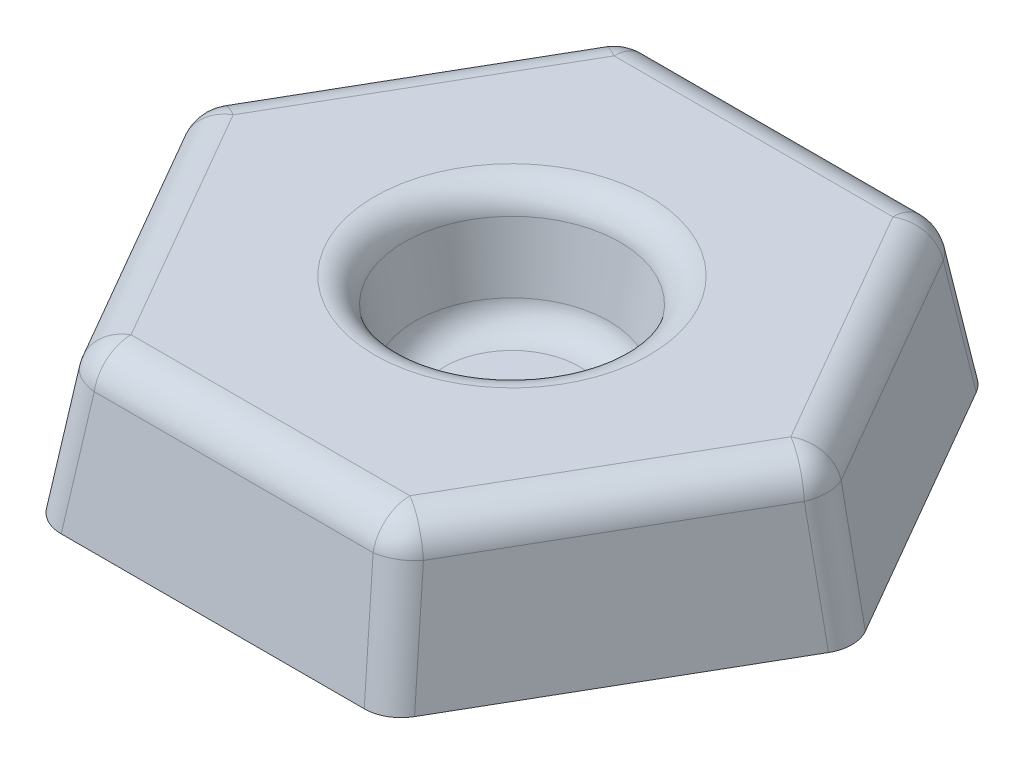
SolidWorks part; units mm, degrees
ref_plane "Front" through (0, 0, 0) normal (0, 0, 1) x (1, 0, 0)
ref_plane "Top" through (0, 0, 0) normal (0, 1, 0) x (1, 0, 0)
ref_plane "Right" through (0, 0, 0) normal (1, 0, 0) x (0, 0, -1)
sketch "Sketch1" plane through (0, 0, 0) normal (0, 1, 0) x (1, 0, 0)
  line L1 (-46.188, 0) -> (-23.094, -40)
  line L2 (-23.094, -40) -> (23.094, -40)
  line L3 (23.094, -40) -> (46.188, 0)
  line L4 (46.188, 0) -> (23.094, 40)
  line L5 (23.094, 40) -> (-23.094, 40)
  line L6 (-23.094, 40) -> (-46.188, 0)
  circle A0 centre (0, 0) radius 40 construction
  dimension "D1" = 80
extrude "Boss-Extrude1" add sketch "Sketch1" along normal blind 20 draft 10
sketch "Sketch2" plane through (0, 20, 0) normal (0, 1, 0) x (1, 0, 0)
  circle A0 centre (0, 0) radius 15
  dimension "D1" = 30
extrude "Cut-Extrude1" cut sketch "Sketch2" against normal blind 15 draft 10
fillet "Fillet1" radius 5 6 edges at (22.076, 10, -38.2367) (44.152, 10, 0) (22.076, 10, 38.2367) (-22.076, 10, 38.2367) (-44.152, 10, 0) (-22.076, 10, -38.2367)
fillet "Fillet2" radius 5 12 edges at (-41.3559, 20, 0) (-31.5869, 20, -18.2367) (-20.678, 20, -35.8153) (0, 20, -36.4735) (20.678, 20, -35.8153) (31.5869, 20, -18.2367) (41.3559, 20, 0) (31.5869, 20, 18.2367) (20.678, 20, 35.8153) (0, 20, 36.4735) (-20.678, 20, 35.8153) (-31.5869, 20, 18.2367)
fillet "Fillet3" radius 4 2 edges at (0, 5, 12.3551) (0, 20, 15)
shell "Shell1" thickness 2
ref_plane "Plane1" through (0, 8, 0) normal (0, 1, 0) x (-1, 0, 0)
sketch "Sketch3" plane through (0, 8, 0) normal (0, 1, 0) x (-1, 0, 0)
  line L0 (0, 35.2324) -> (0, 14.9075)
  line L1 (-18.6357, 35.2324) -> (18.6357, 35.2324) construction
  circle A0 centre (0, 0) radius 14.9075 construction
rib "Rib2" sketch "Sketch3" sketch "Sketch3" thickness 1 extrusion direction normal to sketch draft on yes draft angle 2 parameters "D1"=1, "D3"=2
pattern_circular "CirPattern1" count 6 over 360 about axis through (0, 0, 0) along (0, 1, 0) of "Rib2"
